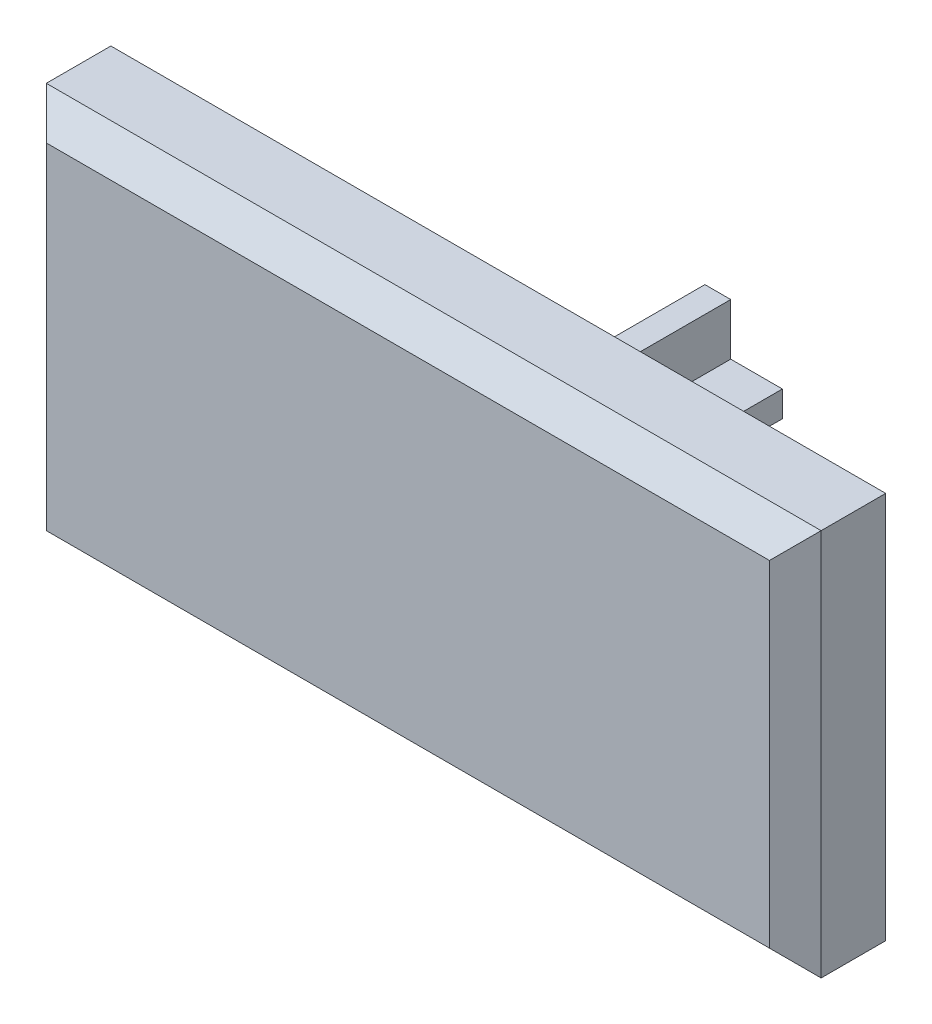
SolidWorks part; units mm, degrees
ref_plane "前视基准面" through (0, 0, 0) normal (0, 0, 1) x (1, 0, 0)
ref_plane "上视基准面" through (0, 0, 0) normal (0, 1, 0) x (1, 0, 0)
ref_plane "右视基准面" through (0, 0, 0) normal (1, 0, 0) x (0, 0, -1)
sketch "草图1" plane through (0, 0, 0) normal (0, 0, 1) x (1, 0, 0)
  line L1 (-15, 7.5) -> (15, 7.5)
  line L2 (-15, 7.5) -> (-15, -7.5)
  line L3 (-15, -7.5) -> (15, -7.5)
  line L4 (15, 7.5) -> (15, -7.5)
  dimension "D1" = 30
  dimension "D2" = 15
  dimension "D3" = 7.5
extrude "凸台-拉伸1" add sketch "草图1" along normal mid plane 3.5
shell "抽壳1" thickness 2
chamfer "倒角1" distance 1 angle 45 4 edges at (15, 0, 1.75) (0, -7.5, 1.75) (-15, 0, 1.75) (0, 7.5, 1.75)
sketch "草图2" plane through (0, 0, -0.25) normal (0, 0, -1) x (-1, 0, 0)
  line L0 (0.5, 0.5) -> (2.5, 0.5)
  line L1 (-2.5, 0.5) -> (-0.5, 0.5)
  line L2 (-2.5, 0.5) -> (-2.5, -0.5)
  line L3 (-2.5, -0.5) -> (-0.5, -0.5)
  line L4 (2.5, 0.5) -> (2.5, -0.5)
  line L5 (-0.5, 2.5) -> (0.5, 2.5)
  line L6 (-0.5, 2.5) -> (-0.5, 0.5)
  line L7 (-0.5, -2.5) -> (0.5, -2.5)
  line L8 (0.5, 2.5) -> (0.5, 0.5)
  line L9 (0.5, -0.5) -> (2.5, -0.5)
  line L10 (-0.5, -0.5) -> (-0.5, -2.5)
  line L11 (0.5, -0.5) -> (0.5, -2.5)
  dimension "D1" = 1
  dimension "D2" = 1
  dimension "D3" = 5
  dimension "D4" = 5
  dimension "D5" = 2
  dimension "D6" = 2
  dimension "D7" = 2.5
  dimension "D8" = 2.5
extrude "凸台-拉伸2" add sketch "草图2" along normal blind 10
